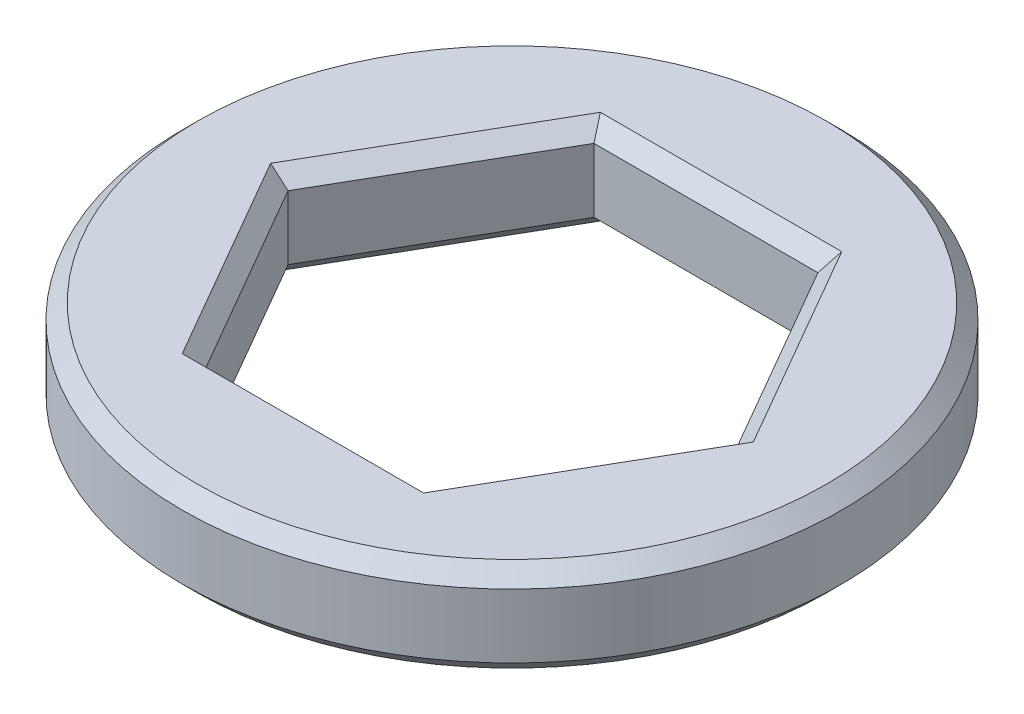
SolidWorks part; units mm, degrees
ref_plane "Front Plane" through (0, 0, 0) normal (0, 0, 1) x (1, 0, 0)
ref_plane "Top Plane" through (0, 0, 0) normal (0, 1, 0) x (1, 0, 0)
ref_plane "Right Plane" through (0, 0, 0) normal (1, 0, 0) x (0, 0, -1)
sketch "Sketch1" plane through (0, 0, 0) normal (0, 1, 0) x (1, 0, 0)
  line L1 (7.5523, 0) -> (3.7762, 6.5405)
  line L2 (3.7762, 6.5405) -> (-3.7762, 6.5405)
  line L3 (-3.7762, 6.5405) -> (-7.5523, 0)
  line L4 (-7.5523, 0) -> (-3.7762, -6.5405)
  line L5 (-3.7762, -6.5405) -> (3.7762, -6.5405)
  line L6 (3.7762, -6.5405) -> (7.5523, 0)
  circle A0 centre (0, 0) radius 6.5405 construction
  circle A1 centre (0, 0) radius 11.1125
  dimension "D1" = 13.081
  dimension "D2" = 22.225
extrude "Boss-Extrude1" add sketch "Sketch1" along normal blind 3.175
chamfer "Chamfer1" distance 0.508 angle 45 14 edges at (0, 0, 6.5405) (-5.6642, 0, 3.2703) (-5.6642, 0, -3.2702) (0, 0, -6.5405) (5.6642, 0, -3.2703) (5.6642, 0, 3.2702) (0, 0, 11.1125) (0, 3.175, 11.1125) (-5.6642, 3.175, 3.2703) (0, 3.175, 6.5405) (5.6642, 3.175, 3.2702) (5.6642, 3.175, -3.2703) (0, 3.175, -6.5405) (-5.6642, 3.175, -3.2702)
